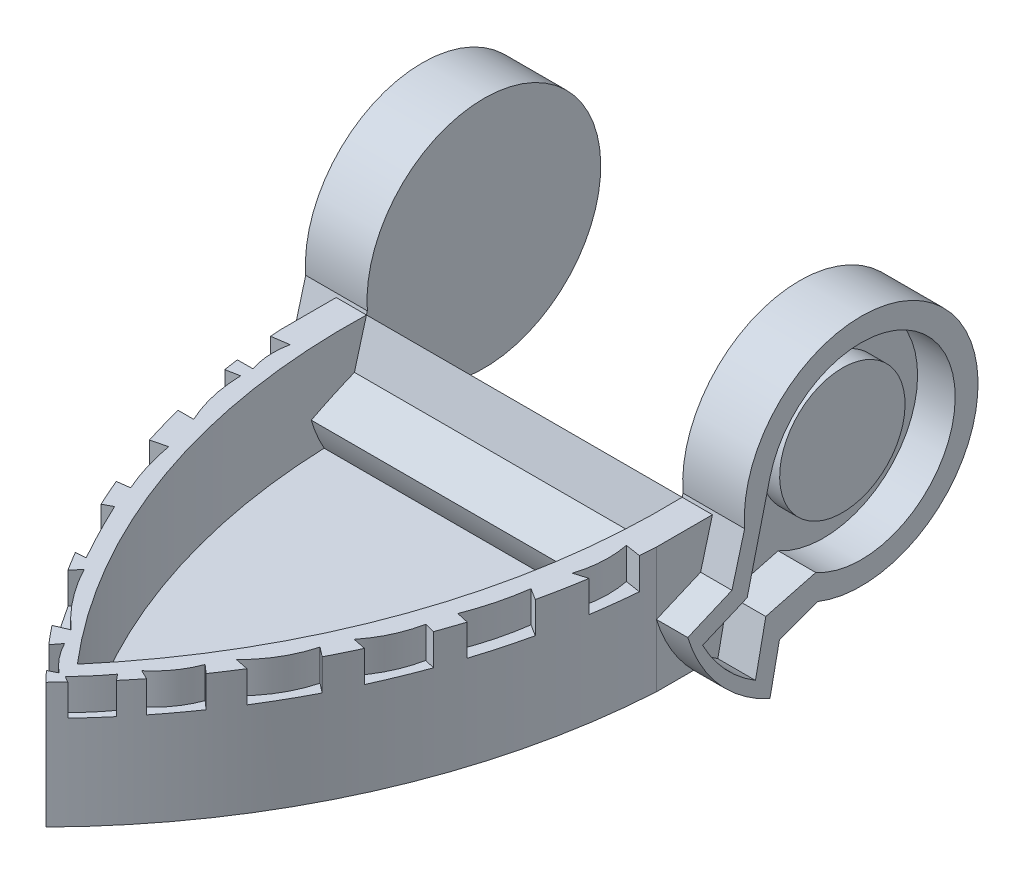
SolidWorks part; units mm, degrees
ref_plane "Front Plane" through (0, 0, 0) normal (0, 0, 1) x (1, 0, 0)
ref_plane "Top Plane" through (0, 0, 0) normal (0, 1, 0) x (1, 0, 0)
ref_plane "Right Plane" through (0, 0, 0) normal (1, 0, 0) x (0, 0, -1)
sketch "Sketch1" plane through (0, 0, 0) normal (0, 0, 1) x (1, 0, 0)
  line L0 (0, 0) -> (152.4, 0)
  line L1 (152.4, 0) -> (152.4, 50.8)
  line L2 (152.4, 50.8) -> (0, 50.8)
  line L3 (0, 50.8) -> (0, 0)
  dimension "D1" = 152.4
  dimension "D2" = 50.8
extrude "Boss-Extrude1" add sketch "Sketch1" along normal blind 203.2
sketch "Sketch5" plane through (0, 50.8, 0) normal (0, 1, 0) x (1, 0, 0)
  line L0 (152.4, -203.2) -> (0, -203.2) construction
  line L1 (0, 0) -> (-12.2557, -203.2)
  line L2 (-12.2557, -203.2) -> (76.2, -203.2)
  line L3 (76.2, -203.2) -> (152.4, -203.2)
  line L4 (152.4, -203.2) -> (152.4, 0)
  arc A0 (0, 0) -> (76.2, -203.2) centre (266.2162, -16.0564) ccw
  arc A1 (76.2, -203.2) -> (152.4, 0) centre (-113.8162, -16.0564) ccw
  dimension "D1" = 266.7
  dimension "D2" = 266.7
extrude "Cut-Extrude2" cut sketch "Sketch5" against normal blind 66.802 contours A0 M2 M3 | A1 M3 M4
sketch "Sketch6" plane through (0, 50.8, 0) normal (0, 1, 0) x (1, 0, 0)
  line L0 (12.7, 0) -> (139.7, 0)
  line L1 (152.4, 0) -> (0, 0) construction
  line L2 (0, -32.1128) -> (0, 0) construction
  arc A0 (139.7, 0) -> (76.2, -190.5) centre (-126.4502, -17.1166) cw
  arc A1 (12.7, 0) -> (76.2, -190.5) centre (278.8502, -17.1166) ccw
  dimension "D1" = 266.7
  dimension "D2" = 266.7
  dimension "D5" = 12.7
  dimension "D6" = 12.7
  dimension "D3" = 0
  dimension "D4" = 12.7
extrude "Cut-Extrude3" cut sketch "Sketch6" against normal blind 38.1
sketch "Sketch7" plane through (0, 0, 0) normal (-1, 0, 0) x (0, 0, 1)
  line L0 (32.1128, 0) -> (32.1128, 50.8) construction
  line L1 (-1.1519, -12.7) -> (-4.9965, 5.958)
  line L2 (-4.9965, 5.958) -> (-20.4697, 11.7167)
  line L3 (9.0948, 52.07) -> (14.2226, 33.02)
  line L4 (14.2226, 33.02) -> (32.1128, 25.4)
  line L5 (32.1128, 0) -> (0, 0) construction
  arc A0 (32.1128, 25.4) -> (-1.1519, -12.7) centre (-26.7345, 43.2074) cw
  arc A1 (-20.4697, 11.7167) -> (9.0948, 52.07) centre (-38.1178, 55.6532) cw
  dimension "D1" = 16.51
  dimension "D2" = 19.05
  dimension "D3" = 7.62
  dimension "D4" = 12.7
  dimension "D5" = 19.05
extrude "Boss-Extrude2" add sketch "Sketch7" along normal blind 12.7 and the other way blind 165.1
sketch "Sketch8" plane through (0, 50.8, 0) normal (0, 1, 0) x (1, 0, 0)
  line L0 (12.2608, -9.4367) -> (140.1392, -9.4367)
  line L1 (12.2608, -9.4367) -> (12.2608, 90.0732)
  line L2 (140.1392, -9.4367) -> (140.1392, 90.0732)
  line L3 (12.2608, 90.0732) -> (140.1392, 90.0732)
extrude "Cut-Extrude4" cut sketch "Sketch8" against normal blind 114.3 and the other way blind 86.106
sketch "Sketch9" plane through (-12.7, 0, 0) normal (-1, 0, 0) x (0, 0, 1)
  line L4 (-19.7304, 22.2839) -> (-0.1278, 13.7941)
  line L5 (-0.1278, 13.7941) -> (3.2096, -2.4024)
  line L6 (22.1299, 22.75) -> (8.2669, 28.6547)
  line L7 (8.2669, 28.6547) -> (-0.0178, 55.6532)
  line L9 (-4.9965, 5.958) -> (-1.1519, -12.7) construction
  line L10 (14.2226, 33.02) -> (32.1128, 25.4) construction
  circle A0 centre (-38.1178, 55.6532) radius 38.1
  arc A1 (9.0948, 52.07) -> (-20.4697, 11.7167) centre (-38.1178, 55.6532) ccw construction
  arc A4 (-19.7304, 22.2839) -> (-0.2692, 51.2834) centre (-38.1178, 55.6532) ccw
  arc A5 (3.2096, -2.4024) -> (22.1299, 22.75) centre (-13.0715, 29.5371) ccw
  dimension "D1" = 76.2
  dimension "D2" = 0
  dimension "D3" = 6.35
  dimension "D5" = 6.35
  dimension "D4" = 6.35
  dimension "D6" = 6.35
extrude "Cut-Extrude5" cut sketch "Sketch9" against normal blind 15.24
sketch "Sketch10" plane through (165.1, 0, 0) normal (1, 0, 0) x (0, 0, -1)
  line L0 (1.1144, 64.7283) -> (-8.0483, 27.3674)
  line L1 (-8.0483, 27.3674) -> (-26.1024, 19.6776)
  line L2 (-4.7003, -3.3441) -> (-0.5132, 16.9759)
  line L3 (-0.5132, 16.9759) -> (19.732, 22.283)
  line L6 (4.9965, 5.958) -> (1.1519, -12.7) construction
  line L7 (20.4697, 11.7167) -> (4.9965, 5.958) construction
  line L8 (-32.1128, 25.4) -> (-14.2226, 33.02) construction
  circle A0 centre (38.1178, 55.6532) radius 38.1
  arc A1 (20.4697, 11.7167) -> (-9.0948, 52.07) centre (38.1178, 55.6532) ccw construction
  arc A3 (1.1144, 64.7283) -> (19.732, 22.283) centre (38.1178, 55.6532) ccw
  arc A5 (-26.1024, 19.6776) -> (-4.7003, -3.3441) centre (25.8195, 46.4875) ccw
  arc A6 (1.1144, 64.7283) -> (19.732, 22.283) centre (38.1178, 55.6532) ccw
  dimension "D1" = 76.2
  dimension "D2" = 0
  dimension "D5" = 20.32
  dimension "D3" = 10.2092
  dimension "D4" = 7.62
  dimension "D6" = 10.16
  dimension "D7" = 7.62
  dimension "D8" = 7.62
  dimension "D9" = 7.62
extrude "Cut-Extrude7" cut sketch "Sketch10" against normal blind 15.24 contours L1 A5 L2 L3 A0 L0 | A0 A3
sketch "Sketch12" plane through (2.54, 0, 0) normal (-1, 0, 0) x (0, 0, 1)
  circle A0 centre (-38.1178, 55.6532) radius 25.4
  arc A1 (-0.0178, 55.6532) -> (-19.7304, 22.2839) centre (-38.1178, 55.6532) ccw construction
  dimension "D1" = 50.8
  dimension "D2" = 0
extrude "Boss-Extrude3" add sketch "Sketch12" along normal blind 7.62
sketch "Sketch13" plane through (149.86, 0, 0) normal (1, 0, 0) x (0, 0, -1)
  circle A0 centre (38.1178, 55.6532) radius 25.4
  arc A1 (19.732, 22.283) -> (1.1144, 64.7283) centre (38.1178, 55.6532) ccw construction
  dimension "D1" = 50.8
  dimension "D2" = 0
extrude "Boss-Extrude5" add sketch "Sketch13" along normal blind 7.62
sketch "Sketch18" plane through (0, 50.8, 0) normal (0, 1, 0) x (1, 0, 0)
  line L0 (7.209, -35.321) -> (-18.4403, -39.0733)
  line L1 (-18.4403, -39.0733) -> (-16.6498, -51.3129)
  line L2 (-16.6498, -51.3129) -> (8.1287, -51.3129)
  line L3 (8.1287, -56.2908) -> (-16.6498, -60.8712)
  line L4 (-16.6498, -60.8712) -> (-12.9211, -81.0422)
  line L5 (-12.9211, -81.0422) -> (13.8509, -81.0422)
  line L6 (18.4135, -95.674) -> (-8.519, -102.577)
  line L7 (-8.519, -102.577) -> (-3.6199, -121.691)
  line L8 (-3.6199, -121.691) -> (25.1292, -117.8119)
  line L9 (28.4633, -127.6646) -> (4.2063, -140.5253)
  line L10 (4.2063, -140.5253) -> (9.7005, -153.8048)
  line L11 (9.7005, -153.8048) -> (40.6729, -151.3925)
  line L12 (44.3754, -155.9344) -> (28.4633, -173.5002)
  line L13 (28.4633, -173.5002) -> (39.6734, -189.4642)
  line L14 (39.6734, -189.4642) -> (62.8955, -179.7459)
  line L15 (66.3558, -185.8338) -> (55.3263, -200.2157)
  line L16 (55.3263, -200.2157) -> (58.976, -205.4131)
  line L17 (58.976, -205.4131) -> (75.5582, -197.2741)
  line L18 (78.0114, -197.2741) -> (90.2489, -204.1576)
  line L19 (90.2489, -204.1576) -> (97.4826, -197.7695)
  line L20 (97.4826, -197.7695) -> (87.8487, -185.8338)
  line L21 (91.5409, -179.7459) -> (105.5271, -186.4637)
  line L22 (105.5271, -186.4637) -> (113.663, -174.8537)
  line L23 (113.663, -174.8537) -> (102.1878, -164.7206)
  line L24 (106.8332, -156.6521) -> (123.5527, -160.0668)
  line L25 (123.5527, -160.0668) -> (131.0496, -144.4586)
  line L26 (131.0496, -144.4586) -> (119.3568, -135.3436)
  line L27 (123.5527, -125.7191) -> (138.7657, -128.8261)
  line L28 (138.7657, -128.8261) -> (145.7156, -109.1459)
  line L29 (145.7156, -109.1459) -> (132.7724, -105.9224)
  line L30 (135.5012, -95.674) -> (147.448, -98.3461)
  line L31 (147.448, -98.3461) -> (152.6801, -79.1375)
  line L32 (152.6801, -79.1375) -> (141.6036, -72.1217)
  line L33 (144.5195, -58.3207) -> (155.4385, -55.0841)
  line L34 (155.4385, -55.0841) -> (171.3594, -41.6228)
  line L35 (171.3594, -41.6228) -> (145.7156, -37.5938)
  arc A0 (40.6729, -151.3925) -> (28.4633, -127.6646) centre (343.3659, 19.3687) cw
  arc A1 (25.1292, -117.8119) -> (18.4135, -95.674) centre (110.1854, -79.9221) cw
  arc A2 (13.8509, -81.0422) -> (8.1287, -56.2908) centre (69.7409, -55.0841) cw
  arc A3 (44.3754, -155.9344) -> (62.8955, -179.7459) centre (119.3568, -116.7235) ccw
  arc A4 (66.3558, -185.8338) -> (75.5582, -197.2741) centre (99.3672, -168.7012) ccw
  arc A5 (78.0114, -197.2741) -> (87.8487, -185.8338) centre (13.8509, -132.1539) ccw
  arc A6 (91.5409, -179.7459) -> (102.1878, -164.7206) centre (68.8468, -152.3801) ccw
  arc A7 (106.8332, -156.6521) -> (119.3568, -135.3436) centre (74.2193, -123.1494) ccw
  arc A8 (123.5527, -125.7191) -> (132.7724, -105.9224) centre (87.3059, -96.7932) ccw
  arc A9 (135.5012, -95.674) -> (141.6036, -72.1217) centre (37.6487, -57.7537) ccw
  arc A10 (144.5195, -58.3207) -> (145.7156, -37.5938) centre (105.5271, -45.6725) ccw
  arc A11 (8.1287, -51.3129) -> (7.209, -35.321) centre (37.1259, -41.6228) cw
extrude "Cut-Extrude10" cut sketch "Sketch18" against normal blind 12.7
scale "Scale1" bodies to scale 113 scale about centroid uniform scaling yes scale factor 0.75
